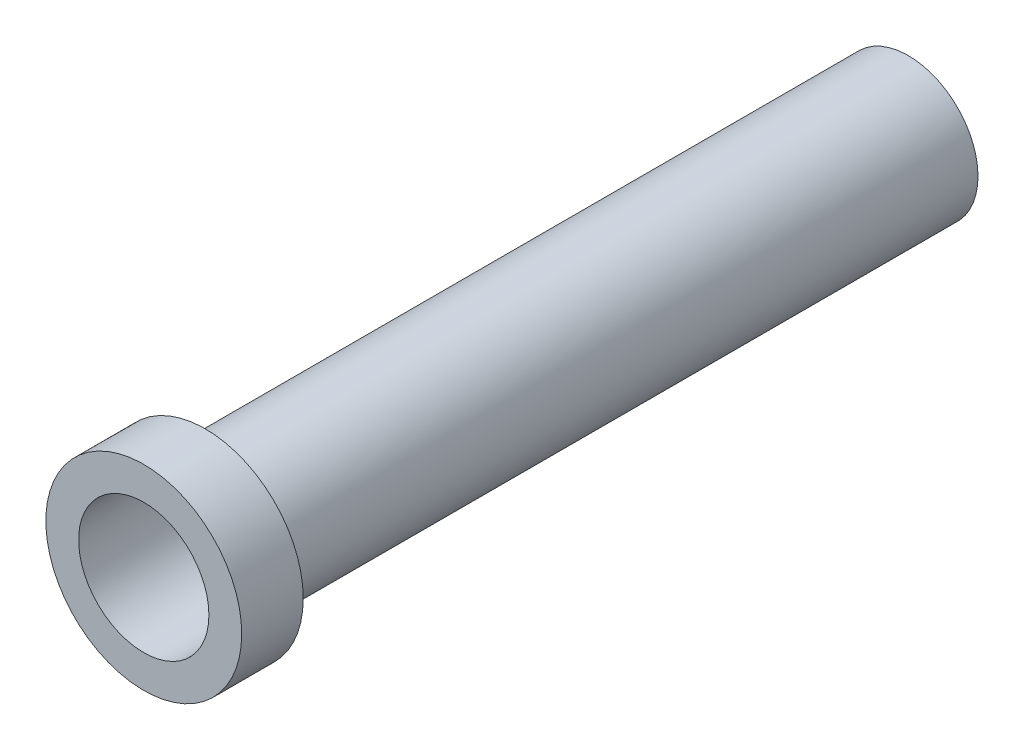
SolidWorks part; units mm, degrees
ref_plane "Front" through (0, 0, 0) normal (0, 0, 1) x (1, 0, 0)
ref_plane "Top" through (0, 0, 0) normal (0, 1, 0) x (1, 0, 0)
ref_plane "Right" through (0, 0, 0) normal (1, 0, 0) x (0, 0, -1)
sketch "Sketch1" plane through (0, 0, 0) normal (0, 0, 1) x (1, 0, 0)
  circle A0 centre (0, 0) radius 26.9875
  circle A1 centre (0, 0) radius 25.2095
  dimension "D1" = 53.975
  dimension "D2" = 50.419
extrude "Boss-Extrude2" add sketch "Sketch1" along normal blind 295.91
sketch "Sketch2" plane through (0, 0, 295.91) normal (0, 0, 1) x (1, 0, 0)
  circle A0 centre (0, 0) radius 25.2095
  circle A1 centre (0, 0) radius 37.9095
  dimension "D1" = 12.7
extrude "Boss-Extrude3" add sketch "Sketch2" against normal blind 23.8125
